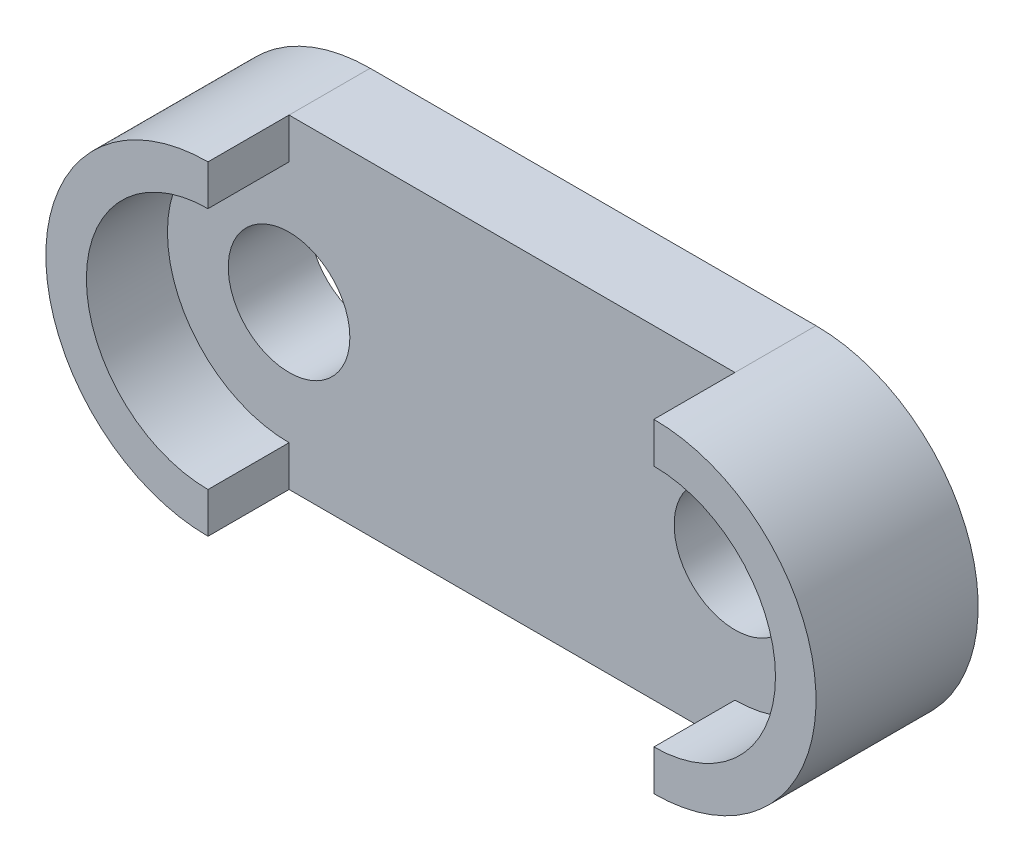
SolidWorks part; units mm, degrees
ref_plane "Face" through (0, 0, 0) normal (0, 0, 1) x (1, 0, 0)
ref_plane "Dessus" through (0, 0, 0) normal (0, 1, 0) x (1, 0, 0)
ref_plane "Droite" through (0, 0, 0) normal (1, 0, 0) x (0, 0, -1)
sketch "Esquisse1" plane through (0, 0, 0) normal (0, 0, 1) x (1, 0, 0)
  line L0 (0, 0) -> (5.5, 0) construction
  line L1 (-5.5, 4) -> (5.5, 4)
  line L2 (0, 0) -> (-5.5, 0) construction
  line L3 (-5.5, -4) -> (5.5, -4)
  line L5 (0, 0) -> (0, -4) construction
  arc A0 (5.5, 4) -> (5.5, -4) centre (5.5, 0) cw
  arc A1 (-5.5, 4) -> (-5.5, -4) centre (-5.5, 0) ccw
  circle A2 centre (5.5, 0) radius 1.5
  circle A3 centre (-5.5, 0) radius 1.5
  dimension "D3" = 3
  dimension "D1" = 8
  dimension "D2" = 11
extrude "Prisme de base" add sketch "Esquisse1" along normal mid plane 2
sketch "Esquisse2" plane through (0, 0, 1) normal (0, 0, 1) x (1, 0, 0)
  arc A0 (5.5, -4) -> (5.5, 4) centre (5.5, 0) ccw construction
  arc A1 (5.5, -4) -> (5.5, 4) centre (5.5, 0) ccw
extrude "Extru.-Mince1" add sketch "Esquisse2" along normal blind 2 thin
mirror "Symétrie1" about plane through (0, 0, 0) normal (1, 0, 0)
